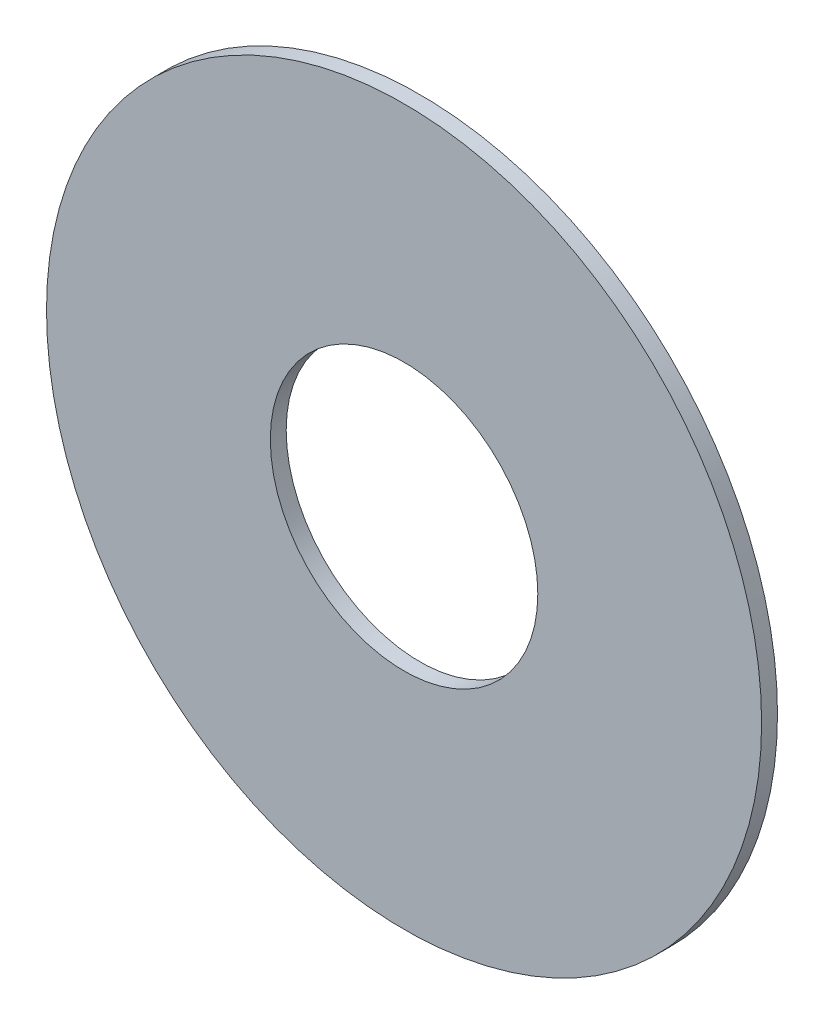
SolidWorks part; units mm, degrees
ref_plane "Plane1" through (0, 0, 0) normal (0, 0, 1) x (1, 0, 0)
ref_plane "Plane2" through (0, 0, 0) normal (0, 1, 0) x (1, 0, 0)
ref_plane "Plane3" through (0, 0, 0) normal (1, 0, 0) x (0, 0, -1)
sketch "Sketch2" plane through (0, 0, 0) normal (0, 0, 1) x (1, 0, 0)
  circle A0 centre (0, 0) radius 17.145
  circle A1 centre (0, 0) radius 6.4135
  dimension "D1" = 34.29
  dimension "D2" = 12.827
extrude "Base-Extrude" add sketch "Sketch2" along normal blind 0.762
